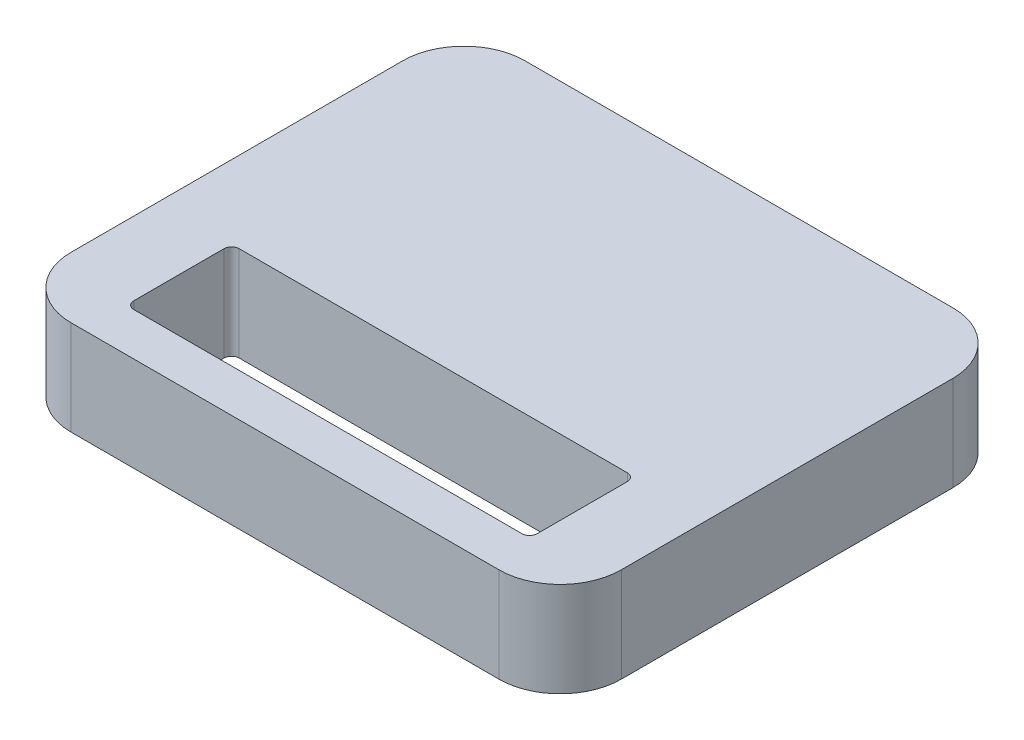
SolidWorks part; units mm, degrees
ref_plane "Front Plane" through (0, 0, 0) normal (0, 0, 1) x (1, 0, 0)
ref_plane "Top Plane" through (0, 0, 0) normal (0, 1, 0) x (1, 0, 0)
ref_plane "Right Plane" through (0, 0, 0) normal (1, 0, 0) x (0, 0, -1)
sketch "Sketch1" plane through (0, 0, 0) normal (0, 1, 0) x (1, 0, 0)
  line L0 (13.2, 3.45) -> (-13.2, 3.45)
  line L1 (13, -3.25) -> (-13, -3.25) construction
  line L2 (13, -3.25) -> (13, 3.25) construction
  line L3 (13, 3.25) -> (-13, 3.25) construction
  line L4 (-13, -3.25) -> (-13, 3.25) construction
  line L5 (13, -3.25) -> (-13, 3.25) construction
  line L6 (13, 3.25) -> (-13, -3.25) construction
  line L7 (-13.2, -3.45) -> (-13.2, 3.45)
  line L8 (13.2, -3.45) -> (-13.2, -3.45)
  line L9 (13.2, -3.45) -> (13.2, 3.45)
  line L15 (-18, 23.45) -> (18, 23.45)
  line L16 (-18, 23.45) -> (-18, -6.25)
  line L17 (-18, -6.25) -> (18, -6.25)
  line L18 (18, 23.45) -> (18, -6.25)
  point P0 (0, 0)
  point P14 (0, -6.25)
  dimension "D1" = 6.5
  dimension "D2" = 26
  dimension "D4" = 3
  dimension "D5" = 5
  dimension "D6" = 20
  dimension "D3" = 0.2
extrude "Boss-Extrude1" add sketch "Sketch1" along normal blind 6.2
fillet "Fillet1" radius 4 4 edges at (18, 3.1, -23.45) (18, 3.1, 6.25) (-18, 3.1, 6.25) (-18, 3.1, -23.45)
fillet "Fillet2" radius 0.5 4 edges at (-13.2, 3.1, 3.45) (13.2, 3.1, 3.45) (13.2, 3.1, -3.45) (-13.2, 3.1, -3.45)
